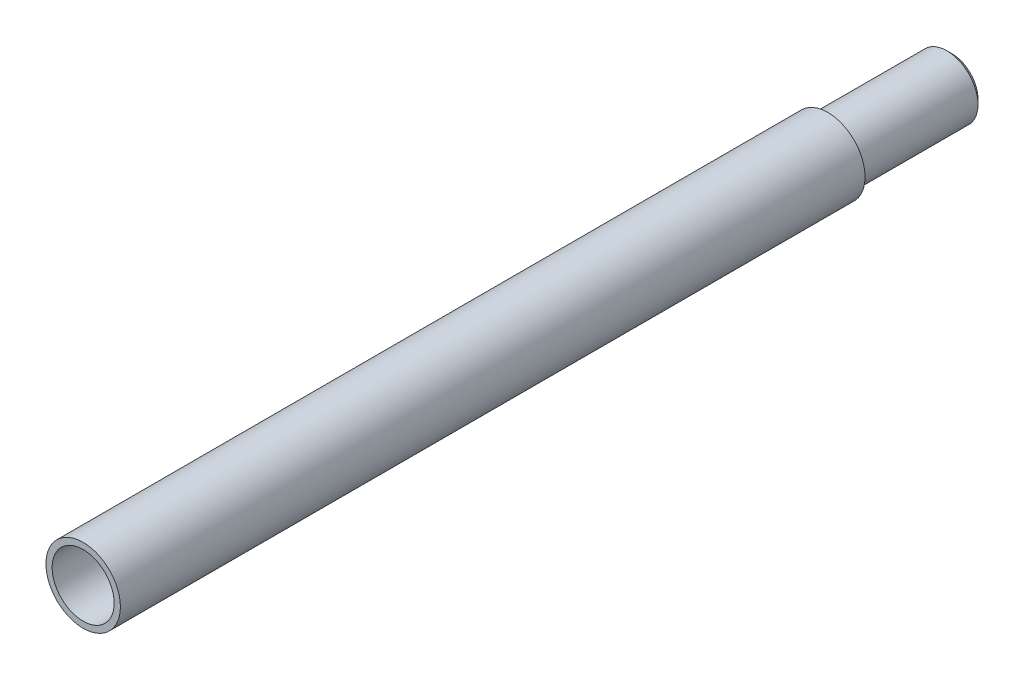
SolidWorks part; units mm, degrees
ref_plane "Plane1" through (0, 0, 0) normal (0, 0, 1) x (1, 0, 0)
ref_plane "Plane2" through (0, 0, 0) normal (0, 1, 0) x (1, 0, 0)
ref_plane "Plane3" through (0, 0, 0) normal (1, 0, 0) x (0, 0, -1)
sketch "Esquisse1" plane through (0, 0, 0) normal (0, 0, 1) x (1, 0, 0)
  circle A0 centre (0, 0) radius 12.5
  circle A1 centre (0, 0) radius 15
  dimension "D1" = 25
  dimension "D2" = 30
extrude "Base-Extrusion" add sketch "Esquisse1" along normal blind 300
sketch "Esquisse2" plane through (0, 0, 0) normal (0, 0, -1) x (-1, 0, 0)
  circle A0 centre (0, 0) radius 12.5005
  dimension "D1" = 25.001
extrude "Boss.-Extru.3" add sketch "Esquisse2" along normal blind 50
chamfer "Chanfrein1" distance 2 angle 45
